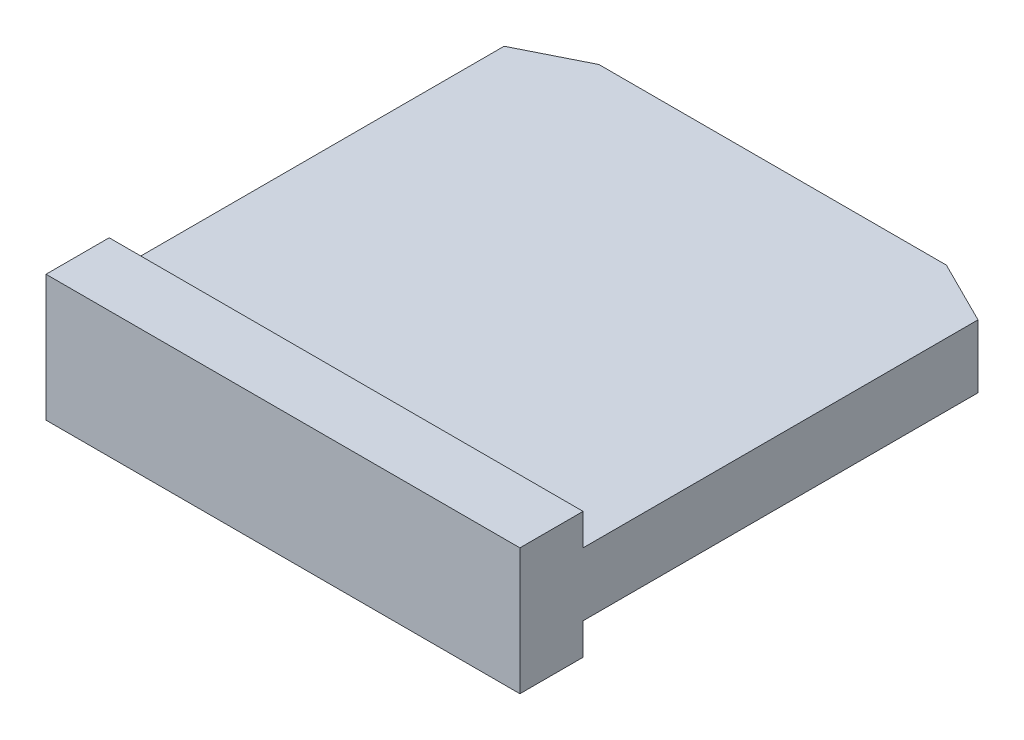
SolidWorks part; units mm, degrees
ref_plane "前视基准面" through (0, 0, 0) normal (0, 0, 1) x (1, 0, 0)
ref_plane "上视基准面" through (0, 0, 0) normal (0, 1, 0) x (1, 0, 0)
ref_plane "右视基准面" through (0, 0, 0) normal (1, 0, 0) x (0, 0, -1)
sketch "草图1" plane through (0, 0, 0) normal (0, 0, 1) x (1, 0, 0)
  line L0 (0, 0) -> (0, 4)
  line L1 (15, 0) -> (15, 4)
  line L2 (0, 0) -> (15, 0)
  line L3 (0, 4) -> (15, 4)
extrude "凸台-拉伸1" add sketch "草图1" along normal blind 15.5
sketch "草图2" plane through (15, 0, 0) normal (1, 0, 0) x (0, 0, -1)
  line L0 (0, 1) -> (0, 3)
  line L1 (-15.5, 0) -> (-15.5, 4)
  line L2 (-13.5, 0) -> (-13.5, 1)
  line L3 (-13.5, 1) -> (0, 1)
  line L4 (-13.5, 3) -> (0, 3)
  line L5 (-15.5, 0) -> (-13.5, 0)
  line L6 (-15.5, 4) -> (-13.5, 4)
  line L7 (-13.5, 3) -> (-13.5, 4)
extrude "切除-拉伸1" cut sketch "草图2" against normal blind 15.5 flip side to cut
sketch "草图3" plane through (0, 4, 0) normal (0, 1, 0) x (1, 0, 0)
  line L0 (0, -15.5) -> (0, -1)
  line L1 (15, -15.5) -> (15, -1)
  line L2 (2, 0) -> (13, 0)
  line L3 (0, -15.5) -> (15, -15.5)
  line L4 (0, -1) -> (2, 0)
  line L5 (13, 0) -> (15, -1)
extrude "切除-拉伸2" cut sketch "草图3" against normal blind 15.5 flip side to cut
